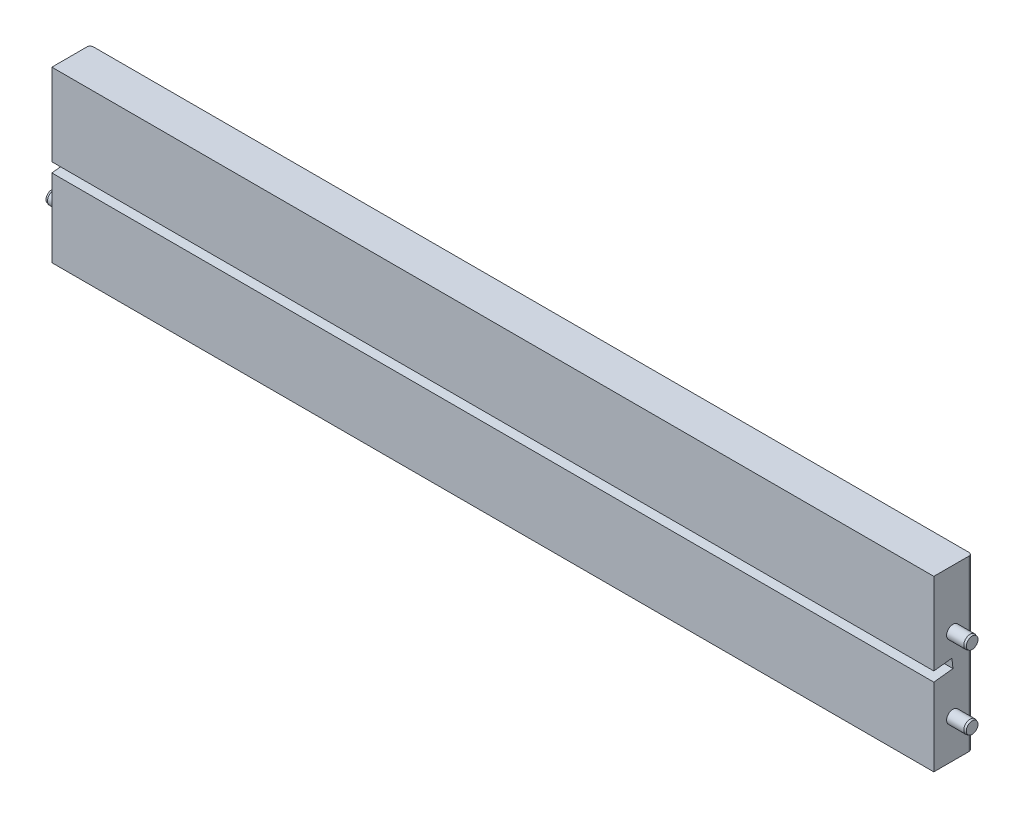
SolidWorks part; units mm, degrees
other "<parallel pin hardened_bsi>-<Base-Revolve>"
other "<parallel pin hardened_bsi>-<Base-Revolve>"
other "<parallel pin hardened_bsi>-<Base-Revolve>"
ref_plane "Front Plane" through (0, 0, 0) normal (0, 0, 1) x (1, 0, 0)
ref_plane "Top Plane" through (0, 0, 0) normal (0, 1, 0) x (1, 0, 0)
ref_plane "Right Plane" through (0, 0, 0) normal (1, 0, 0) x (0, 0, -1)
body saved out of another part "Stock-Donut Shop-1"
hole_wizard "CBORE for M4 Pan Head Machine Screw" positions "3DSketch1" profile "Sketch1" counterbore size "M4" standard "ANSI Metric"
sketch3d "3DSketch1"
  point P0 (-240, 216, -84)
  point P3 (-240, 47, -99)
  point P6 (-240, 6, -99)
  point P9 (-240, 47, 99)
  point P12 (-240, 6, 99)
sketch "Sketch1" plane through (-240, 216, -84) normal (0, 1, 0) x (0, 0, 1)
  line L0 (0, 0) -> (0, 30)
  line L1 (0, 30) -> (2.25, 28.6481)
  line L2 (2.25, 28.6481) -> (2.25, 3.1)
  line L3 (2.25, 3.1) -> (4.5, 3.1)
  line L4 (4.5, 3.1) -> (4.5, 0)
  line L5 (4.5, 0) -> (0, 0)
  line L6 (0, 30) -> (-2.25, 28.6481) construction
  line L7 (0, -6.35) -> (0, 107.95) construction
  dimension "Hole Dia." = 4.5
  dimension "Hole Depth" = 30
  dimension "C'Bore Dia." = 9
  dimension "C'Bore Depth" = 3.1
  dimension "Drill Angle" = 118
hole_wizard "Ø4.0mm Dowel Hole1" positions "3DSketch2" profile "Sketch2" hole size "Ø4.0" standard "ANSI Metric"
sketch3d "3DSketch2"
  point P0 (48, 47, -99)
  point P3 (48, 47, 99)
  point P6 (48, 216, -84)
  point P9 (48, 24, -99)
  point P13 (48, 24, 99)
sketch "Sketch2" plane through (48, 47, -99) normal (0, 1, 0) x (0, 0, 1)
  line L0 (0, 0) -> (0, 6)
  line L1 (0, 6) -> (2, 6)
  line L2 (2, 6) -> (2, 0)
  line L3 (2, 0) -> (0, 0)
  line L4 (0, 6) -> (-2, 6) construction
  line L5 (0, -6.35) -> (0, 107.95) construction
  dimension "Hole Dia." = 4
  dimension "Hole Depth" = 6
  dimension "Drill Angle" = 180
hole_wizard "Ø4.0mm Dowel Hole2" positions "3DSketch3" profile "Sketch3" hole size "Ø4.0" standard "ANSI Metric"
sketch3d "3DSketch3"
  point P0 (48, 47, -99)
  point P4 (48, 47, 99)
  point P8 (48, 216, -84)
  point P11 (48, 24, -99)
  point P14 (48, 24, 99)
sketch "Sketch3" plane through (48, 47, -99) normal (0, 1, 0) x (0, 0, -1)
  line L0 (0, 0) -> (0, 14)
  line L1 (0, 14) -> (2, 14)
  line L2 (2, 14) -> (2, 0)
  line L3 (2, 0) -> (0, 0)
  line L4 (0, 14) -> (-2, 14) construction
  line L5 (0, -6.35) -> (0, 107.95) construction
  dimension "Hole Dia." = 4
  dimension "Hole Depth" = 14
  dimension "Drill Angle" = 180
hole_wizard "Ø4.0mm Dowel Hole3" positions "3DSketch4" profile "Sketch4" hole size "Ø4.0" standard "ANSI Metric"
sketch3d "3DSketch4"
  point P0 (-228, 24, -99)
  point P3 (-228, 24, 99)
sketch "Sketch4" plane through (-228, 24, -99) normal (0, 1, 0) x (0, 0, -1)
  line L0 (0, 0) -> (0, 6)
  line L1 (0, 6) -> (2, 6)
  line L2 (2, 6) -> (2, 0)
  line L3 (2, 0) -> (0, 0)
  line L4 (0, 6) -> (-2, 6) construction
  line L5 (0, -6.35) -> (0, 107.95) construction
  dimension "Hole Dia." = 4
  dimension "Hole Depth" = 6
  dimension "Drill Angle" = 180
fillet "Fillet1" radius 1 2 edges at (-228, 38.5, -105) (48, 38.5, -105)
hole_wizard "Ø4.0mm Dowel Hole4" positions "3DSketch5" profile "Sketch5" hole size "Ø4.0" standard "ANSI Metric"
sketch3d "3DSketch5"
  point P0 (-228, 24, -99)
  point P3 (-228, 24, 99)
sketch "Sketch5" plane through (-228, 24, -99) normal (0, 1, 0) x (0, 0, 1)
  line L0 (0, 0) -> (0, 14)
  line L1 (0, 14) -> (2, 14)
  line L2 (2, 14) -> (2, 0)
  line L3 (2, 0) -> (0, 0)
  line L4 (0, 14) -> (-2, 14) construction
  line L5 (0, -6.35) -> (0, 107.95) construction
  dimension "Hole Dia." = 4
  dimension "Hole Depth" = 14
  dimension "Drill Angle" = 180
inserted part "parallel pin hardened_bsi"
inserted part "parallel pin hardened_bsi1"
inserted part "parallel pin hardened_bsi2"
move or copy body "Body-Move/Copy1" bodies to move or copy 108 placed by mates yes
move or copy body "Body-Move/Copy2" bodies to move or copy 107 placed by mates yes
move or copy body "Body-Move/Copy3" bodies to move or copy 109 placed by mates yes
